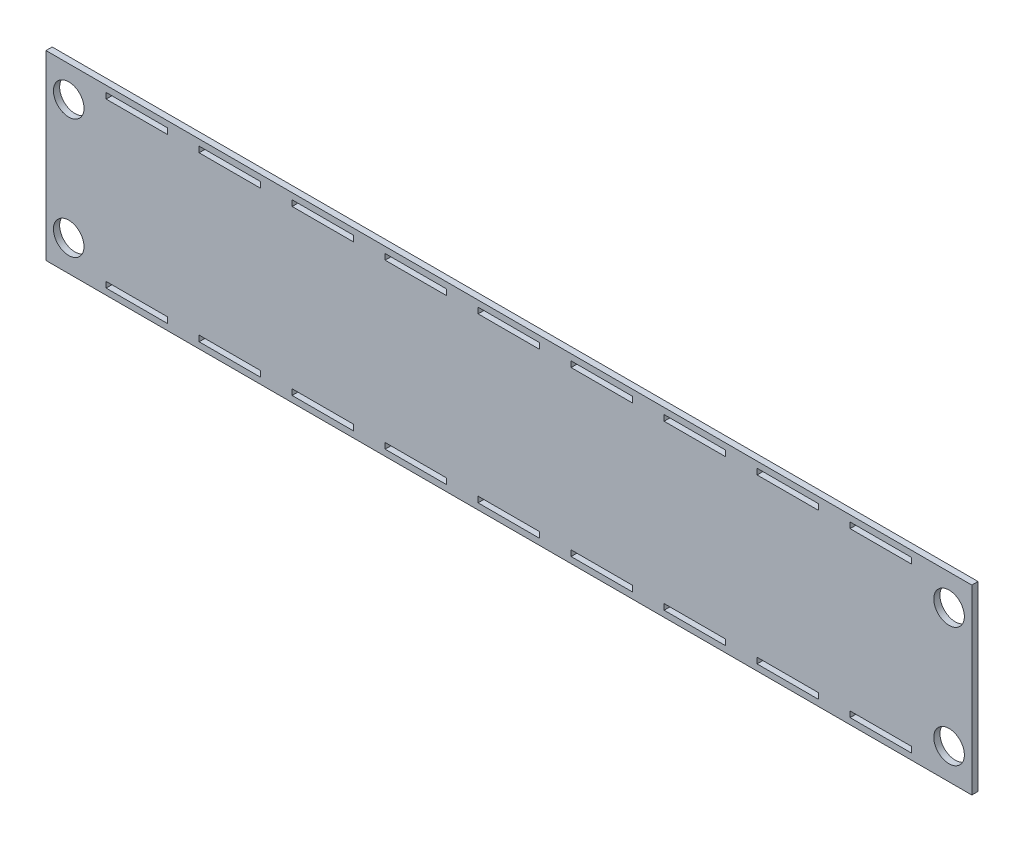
SolidWorks part; units mm, degrees
ref_plane "Alzado" through (0, 0, 0) normal (0, 0, 1) x (1, 0, 0)
ref_plane "Planta" through (0, 0, 0) normal (0, 1, 0) x (1, 0, 0)
ref_plane "Vista lateral" through (0, 0, 0) normal (1, 0, 0) x (0, 0, -1)
sketch "Croquis1" plane through (0, 0, 0) normal (0, 0, 1) x (1, 0, 0)
  line L1 (-224, -44) -> (224, -44)
  line L2 (-224, -44) -> (-224, 44)
  line L3 (-224, 44) -> (224, 44)
  line L4 (224, -44) -> (224, 44)
  line L5 (-224, -44) -> (224, 44) construction
  line L6 (-224, 44) -> (224, -44) construction
  point P0 (0, 0)
  dimension "D1" = 448
  dimension "D2" = 88
extrude "Saliente-Extruir1" add sketch "Croquis1" along normal blind 3
sketch "Croquis2" plane through (0, 0, 3) normal (0, 0, 1) x (1, 0, 0)
  line L0 (0, 44) -> (0, -44) construction
  line L1 (224, 44) -> (-224, 44) construction
  line L2 (-224, -44) -> (224, -44) construction
  line L3 (-224, 0) -> (224, 0) construction
  line L4 (-224, 44) -> (-224, -44) construction
  line L5 (224, -44) -> (224, 44) construction
  line L6 (-14.9, 38.2) -> (-14.9, 41)
  line L7 (-194.9, -38.2) -> (-165.1, -38.2)
  line L8 (-194.9, -38.2) -> (-194.9, -41)
  line L9 (-194.9, -41) -> (-165.1, -41)
  line L10 (-165.1, -38.2) -> (-165.1, -41)
  line L11 (-149.9, -38.2) -> (-120.1, -38.2)
  line L12 (-149.9, -38.2) -> (-149.9, -41)
  line L13 (-149.9, -41) -> (-120.1, -41)
  line L14 (-120.1, -38.2) -> (-120.1, -41)
  line L15 (-104.9, -38.2) -> (-75.1, -38.2)
  line L16 (-104.9, -38.2) -> (-104.9, -41)
  line L17 (-104.9, -41) -> (-75.1, -41)
  line L18 (-75.1, -38.2) -> (-75.1, -41)
  line L19 (-59.9, -38.2) -> (-30.1, -38.2)
  line L20 (-59.9, -38.2) -> (-59.9, -41)
  line L21 (-59.9, -41) -> (-30.1, -41)
  line L22 (-30.1, -38.2) -> (-30.1, -41)
  line L23 (14.9, -38.2) -> (-14.9, -38.2)
  line L25 (14.9, -41) -> (-14.9, -41)
  line L26 (-14.9, -38.2) -> (-14.9, -41)
  line L27 (14.9, 41) -> (-14.9, 41)
  line L29 (14.9, 38.2) -> (-14.9, 38.2)
  line L30 (-30.1, 38.2) -> (-30.1, 41)
  line L31 (-59.9, 41) -> (-30.1, 41)
  line L32 (-59.9, 38.2) -> (-59.9, 41)
  line L33 (-59.9, 38.2) -> (-30.1, 38.2)
  line L34 (-75.1, 38.2) -> (-75.1, 41)
  line L35 (-104.9, 41) -> (-75.1, 41)
  line L36 (-104.9, 38.2) -> (-104.9, 41)
  line L37 (-104.9, 38.2) -> (-75.1, 38.2)
  line L38 (-120.1, 38.2) -> (-120.1, 41)
  line L39 (-149.9, 41) -> (-120.1, 41)
  line L40 (-149.9, 38.2) -> (-149.9, 41)
  line L41 (-149.9, 38.2) -> (-120.1, 38.2)
  line L42 (-165.1, 38.2) -> (-165.1, 41)
  line L43 (-194.9, 41) -> (-165.1, 41)
  line L44 (-194.9, 38.2) -> (-194.9, 41)
  line L45 (-194.9, 38.2) -> (-165.1, 38.2)
  line L46 (194.9, 38.2) -> (165.1, 38.2)
  line L47 (194.9, 38.2) -> (194.9, 41)
  line L48 (194.9, 41) -> (165.1, 41)
  line L49 (165.1, 38.2) -> (165.1, 41)
  line L50 (149.9, 38.2) -> (120.1, 38.2)
  line L51 (149.9, 38.2) -> (149.9, 41)
  line L52 (149.9, 41) -> (120.1, 41)
  line L53 (120.1, 38.2) -> (120.1, 41)
  line L54 (104.9, 38.2) -> (75.1, 38.2)
  line L55 (104.9, 38.2) -> (104.9, 41)
  line L56 (104.9, 41) -> (75.1, 41)
  line L57 (75.1, 38.2) -> (75.1, 41)
  line L58 (59.9, 38.2) -> (30.1, 38.2)
  line L59 (59.9, 38.2) -> (59.9, 41)
  line L60 (59.9, 41) -> (30.1, 41)
  line L61 (30.1, 38.2) -> (30.1, 41)
  line L62 (14.9, -38.2) -> (14.9, -41)
  line L63 (30.1, -38.2) -> (30.1, -41)
  line L64 (59.9, -41) -> (30.1, -41)
  line L65 (59.9, -38.2) -> (59.9, -41)
  line L66 (59.9, -38.2) -> (30.1, -38.2)
  line L67 (75.1, -38.2) -> (75.1, -41)
  line L68 (104.9, -41) -> (75.1, -41)
  line L69 (104.9, -38.2) -> (104.9, -41)
  line L70 (104.9, -38.2) -> (75.1, -38.2)
  line L71 (120.1, -38.2) -> (120.1, -41)
  line L72 (149.9, -41) -> (120.1, -41)
  line L73 (149.9, -38.2) -> (149.9, -41)
  line L74 (149.9, -38.2) -> (120.1, -38.2)
  line L75 (165.1, -38.2) -> (165.1, -41)
  line L76 (194.9, -41) -> (165.1, -41)
  line L77 (194.9, -38.2) -> (194.9, -41)
  line L78 (194.9, -38.2) -> (165.1, -38.2)
  line L79 (14.9, 38.2) -> (14.9, 41)
  point P33 (-45, -38.2)
  point P34 (-90, -38.2)
  point P35 (-135, -38.2)
  point P36 (-180, -38.2)
  dimension "D1" = 3
  dimension "D2" = 14.9
  dimension "D3" = 45
  dimension "D4" = 29.8
  dimension "D5" = 45
  dimension "D6" = 29.8
  dimension "D7" = 45
  dimension "D8" = 29.8
  dimension "D9" = 45
  dimension "D10" = 29.8
  dimension "D11" = 2.8
extrude "Cortar-Extruir1" cut sketch "Croquis2" against normal up to next
sketch "Croquis3" plane through (0, 0, 3) normal (0, 0, 1) x (1, 0, 0)
  line L1 (-213, -29) -> (213, -29) construction
  line L2 (-213, -29) -> (-213, 29) construction
  line L3 (-213, 29) -> (213, 29) construction
  line L4 (213, -29) -> (213, 29) construction
  line L5 (-213, -29) -> (213, 29) construction
  line L6 (-213, 29) -> (213, -29) construction
  circle A0 centre (-213, 29) radius 7.4
  circle A1 centre (-213, -29) radius 7.4
  circle A2 centre (213, -29) radius 7.4
  circle A3 centre (213, 29) radius 7.4
  point P0 (0, 0)
  dimension "D3" = 14.8
  dimension "D4" = 14.8
  dimension "D5" = 14.8
  dimension "D6" = 14.8
  dimension "D1" = 426
  dimension "D2" = 58
extrude "Cortar-Extruir2" cut sketch "Croquis3" against normal up to next
